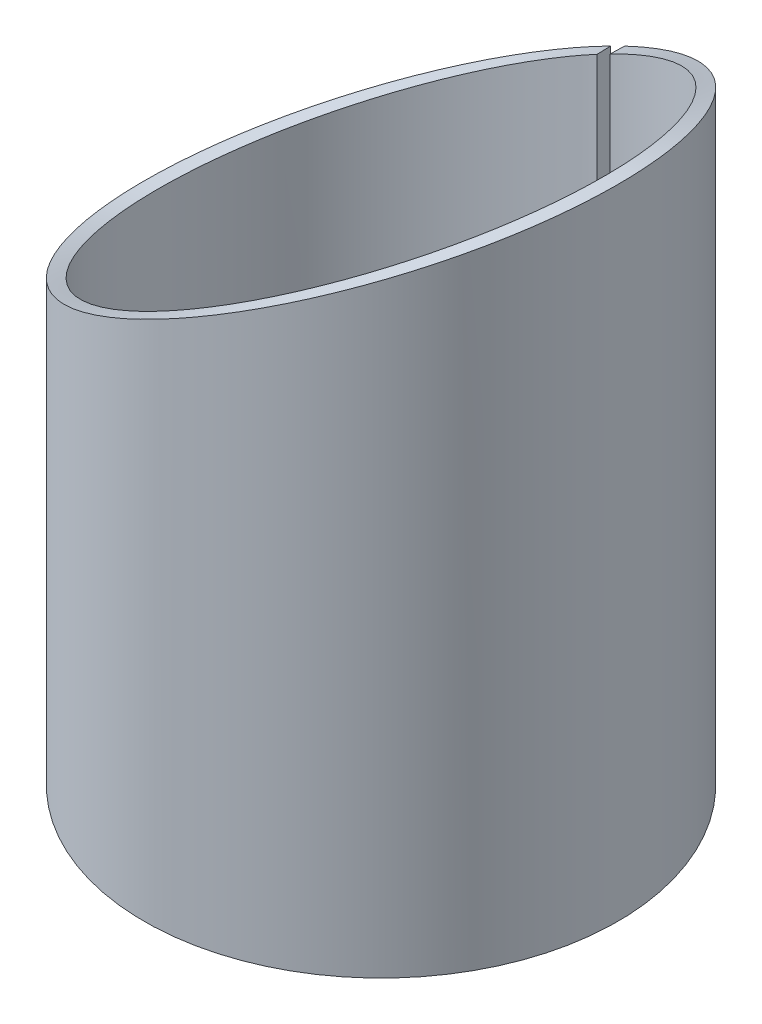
SolidWorks part; units mm, degrees
ref_plane "前视基准面" through (0, 0, 0) normal (0, 0, 1) x (1, 0, 0)
ref_plane "上视基准面" through (0, 0, 0) normal (0, 1, 0) x (1, 0, 0)
ref_plane "右视基准面" through (0, 0, 0) normal (1, 0, 0) x (0, 0, -1)
imported_body "基体零件-长短脚任意角度裤形三通管-1"
sheet metal parameters "钣金1" parameters "D1"=0.7366, "厚度"=1
bend "圆角折弯1" bend radius 15.9772 bend angle 356.625 parameters "D5"=1
flatten bends "展开-折弯1"
sketch "尖角-草图1" plane through (37.0871, -46.6627, -16.9698) normal (0.0295, 0, -0.9996) x (-0.9996, 0, -0.0295)
  line L0 (-49.7232, -18.8269) -> (-49.7232, 18.5804) construction
  dimension "D1" = 0
process bends "加工-折弯1" parameters "D1"=0
sketch "平面-草图1" plane through (37.0871, -46.6627, -16.9698) normal (0.0295, 0, -0.9996) x (-0.9996, 0, -0.0295)
